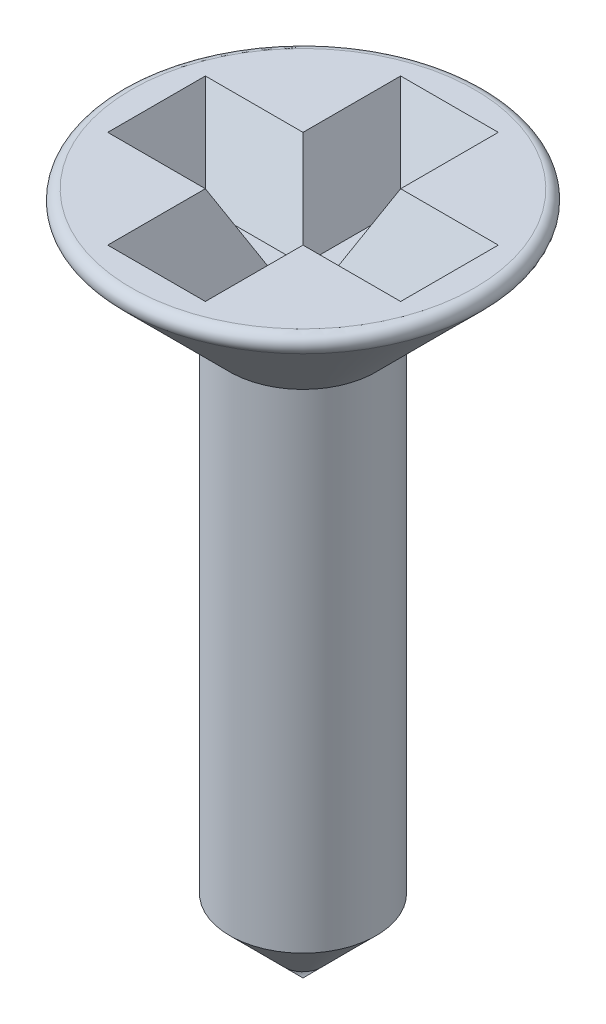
SolidWorks part; units mm, degrees
ref_plane "Face" through (0, 0, 0) normal (0, 0, 1) x (1, 0, 0)
ref_plane "Dessus" through (0, 0, 0) normal (0, 1, 0) x (1, 0, 0)
ref_plane "Droite" through (0, 0, 0) normal (1, 0, 0) x (0, 0, -1)
sketch "Esquisse1" plane through (0, 0, 0) normal (0, 0, 1) x (1, 0, 0)
  line L0 (0, 7) -> (0, 0) construction
  line L1 (0, 7) -> (2, 7)
  line L2 (2, 7) -> (0.75, 5.75)
  line L3 (0.75, 5.75) -> (0.75, 0.75)
  line L4 (0.75, 0.75) -> (0, 0)
  line L5 (0, 7) -> (0, 0)
  dimension "D1" = 7
  dimension "D2" = 2
  dimension "D3" = 1.5
  dimension "D4" = 45
  dimension "D5" = 135
revolve "Révolution1" add sketch "Esquisse1" angle 360 about L0
fillet "Congé1" radius 0.1 1 edges at (-2, 7, 0)
sketch "Esquisse2" plane through (0, 7, 0) normal (0, 1, 0) x (-1, 0, 0)
  line L0 (0, -1.7586) -> (0, 1.7586) construction
  line L1 (1.7586, 0) -> (-1.7586, 0) construction
  line L2 (0.5, -1.5) -> (-0.5, -1.5)
  line L3 (-0.5, -1.5) -> (-0.5, -0.5)
  line L4 (-0.5, -0.5) -> (-1.5, -0.5)
  line L5 (-1.5, -0.5) -> (-1.5, 0.5)
  line L6 (-1.5, 0.5) -> (-0.5, 0.5)
  line L7 (-0.5, 0.5) -> (-0.5, 1.5)
  line L8 (-0.5, 1.5) -> (0.5, 1.5)
  line L9 (0.5, 1.5) -> (0.5, 0.5)
  line L10 (0.5, 0.5) -> (1.5, 0.5)
  line L11 (1.5, 0.5) -> (1.5, -0.5)
  line L12 (1.5, -0.5) -> (0.5, -0.5)
  line L13 (0.5, -0.5) -> (0.5, -1.5)
  circle A0 centre (0, 0) radius 1.7586 construction
  dimension "D1" = 1
  dimension "D2" = 1
extrude "Enlèv. mat.-Extru.2" cut sketch "Esquisse2" against normal blind 0.8
draft "Dépouille1" type of draft neutral plane draft angle 25 faces to draft 12 parameters "D1"=25
